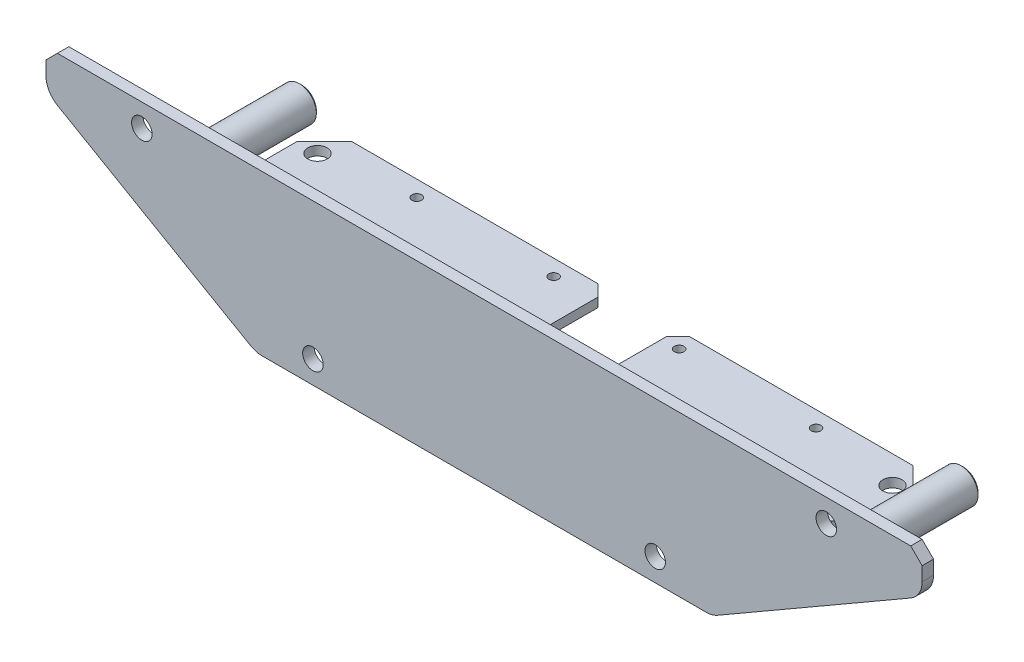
SolidWorks part; units mm, degrees
ref_plane "Face" through (0, 0, 0) normal (0, 0, 1) x (1, 0, 0)
ref_plane "Dessus" through (0, 0, 0) normal (0, 1, 0) x (1, 0, 0)
ref_plane "Droite" through (0, 0, 0) normal (1, 0, 0) x (0, 0, -1)
sketch "Esquisse1" plane through (0, 0, 0) normal (0, 0, 1) x (1, 0, 0)
  line L5 (135, 36) -> (-135, 36)
  line L8 (135, 32) -> (-135, 32)
  line L9 (-135, 32) -> (-135, 36)
  line L11 (135, 32) -> (135, 36)
  dimension "D2" = 32
  dimension "D9" = 4
  dimension "D10" = 270
  dimension "D11" = 135
extrude "Extrusion1" add sketch "Esquisse1" against normal blind 60
sketch "Esquisse2" plane through (0, 0, 0) normal (0, 0, 1) x (1, 0, 0)
  line L0 (100, 0) -> (192, 53.1162)
  line L1 (192, 53.1162) -> (192, 70)
  line L2 (-192, 70) -> (192, 70)
  line L3 (-192, 70) -> (-192, 53.1162)
  line L4 (-192, 53.1162) -> (-100, 0)
  line L6 (-100, 0) -> (100, 0)
  dimension "D1" = 192
  dimension "D2" = 384
  dimension "D3" = 30
  dimension "D4" = 30
  dimension "D5" = 70
  dimension "D6" = 100
extrude "Extrusion2" add sketch "Esquisse2" along normal blind 5 separate body
sketch "Esquisse4" plane through (0, 0, 0) normal (0, 0, -1) x (-1, 0, 0)
  line L0 (-192, 70) -> (192, 70) construction
  circle A0 centre (-150, 60) radius 4.5
  circle A1 centre (-75, 10) radius 4.5
  circle A2 centre (150, 60) radius 4.5
  circle A3 centre (75, 10) radius 4.5
  dimension "D1" = 9
  dimension "D2" = 150
  dimension "D3" = 150
  dimension "D4" = 50
  dimension "D5" = 10
  dimension "D6" = 75
  dimension "D7" = 75
extrude "Enlèv. mat.-Extru.3" cut sketch "Esquisse4" against normal blind 5
sketch "Esquisse6" plane through (0, 0, 0) normal (0, 0, -1) x (-1, 0, 0)
  circle A0 centre (-145, 40) radius 7.5
  circle A1 centre (145, 40) radius 7.5
  dimension "D1" = 15
  dimension "D2" = 15
  dimension "D3" = 40
  dimension "D4" = 145
  dimension "D5" = 145
extrude "Extrusion3" add sketch "Esquisse6" along normal blind 60 separate body
hole_wizard "Trou taraudé M81" positions "Esquisse8" profile "Esquisse7" tap size "M8" standard "ISO"
sketch "Esquisse8" plane through (0, 0, -60) normal (0, 0, -1) x (-1, 0, 0)
  point P0 (-145, 40)
  point P1 (145, 40)
sketch "Esquisse7" plane through (145, 40, -60) normal (1, 0, 0) x (0, 1, 0)
  line L0 (0, 0) -> (0, 21.963)
  line L1 (0, 21.963) -> (3.4, 20)
  line L2 (3.4, 20) -> (3.4, 0)
  line L5 (3.4, 0) -> (0, 0)
  line L10 (0, 21.963) -> (-3.4, 20) construction
  line L11 (0, -6.35) -> (0, 107.95) construction
  dimension "Diamètre du trou pour taraudage" = 6.8
  dimension "Profondeur du trou pour taraudage" = 20
  dimension "Angle de pointe" = 120
chamfer "Chanfrein2" distance 1 angle 45 1 edges at (137.5, 40, -60)
chamfer "Chanfrein3" distance 1 angle 45 1 edges at (-152.5, 40, -60)
sketch "Esquisse9" plane through (0, 36, 0) normal (0, 1, 0) x (-1, 0, 0)
  circle A0 centre (126, -48) radius 4.25
  circle A1 centre (-126, -48) radius 4.25
  dimension "D1" = 8.5
  dimension "D2" = 8.5
  dimension "D3" = 126
  dimension "D4" = 126
  dimension "D5" = 48
extrude "Enlèv. mat.-Extru.5" cut sketch "Esquisse9" against normal blind 5
sketch "Esquisse10" plane through (0, 0, 0) normal (0, 0, -1) x (-1, 0, 0)
  line L0 (135, 32) -> (-135, 32) construction
  line L1 (-42, 32) -> (-32, 32)
  line L2 (-42, 32) -> (-42, 2)
  line L3 (-42, 2) -> (-32, 2)
  line L4 (-32, 32) -> (-32, 2)
  line L6 (13, 32) -> (23, 32)
  line L7 (13, 32) -> (13, 2)
  line L8 (13, 2) -> (23, 2)
  line L9 (23, 32) -> (23, 2)
  dimension "D1" = 30
  dimension "D2" = 10
  dimension "D3" = 32
  dimension "D4" = 10
  dimension "D5" = 65
extrude "Extrusion4" add sketch "Esquisse10" along normal blind 32 separate body
hole_wizard "Trou taraudé M41" positions "Esquisse13" profile "Esquisse12" tap size "M4" standard "ISO"
sketch "Esquisse13" plane through (0, 0, -32) normal (0, 0, -1) x (-1, 0, 0)
  line L0 (-42, 2) -> (-32, 2) construction
  line L1 (-32, 2) -> (-32, 32) construction
  line L2 (13, 32) -> (13, 2) construction
  point P0 (-37, 27)
  point P1 (-37, 7)
  point P9 (18, 27)
  point P11 (18, 7)
  dimension "D1" = 20
  dimension "D2" = 5
  dimension "D3" = 5
  dimension "D4" = 5
sketch "Esquisse12" plane through (37, 27, -32) normal (1, 0, 0) x (0, 1, 0)
  line L0 (0, 0) -> (0, 11.0526)
  line L1 (0, 11.0526) -> (1.65, 10.1)
  line L2 (1.65, 10.1) -> (1.65, 0)
  line L5 (1.65, 0) -> (0, 0)
  line L10 (0, 11.0526) -> (-1.65, 10.1) construction
  line L11 (0, -6.35) -> (0, 107.95) construction
  dimension "Diamètre du trou pour taraudage" = 3.3
  dimension "Profondeur du trou pour taraudage" = 10.1
  dimension "Angle de pointe" = 120
hole_wizard "Trou taraudé M51" positions "Esquisse15" profile "Esquisse14" tap size "M5" standard "ISO"
sketch "Esquisse15" plane through (0, 36, 0) normal (0, 1, 0) x (-1, 0, 0)
  line L0 (-135, 0) -> (135, 0) construction
  line L1 (-27.5, -23) -> (27.5, -23) construction
  line L2 (0, -23) -> (0, 0) construction
  point P0 (-27.5, -53)
  point P1 (-27.5, -23)
  point P2 (-87.5, -23)
  point P4 (27.5, -23)
  point P5 (27.5, -53)
  point P6 (87.5, -23)
  point P17 (-87.5, -53)
  point P19 (87.5, -53)
  dimension "D1" = 60
  dimension "D2" = 23
  dimension "D3" = 60
  dimension "D4" = 30
  dimension "D5" = 55
  dimension "D6" = 30
sketch "Esquisse14" plane through (27.5, 36, -53) normal (1, 0, 0) x (0, 0, 1)
  line L0 (0, 0) -> (0, 36)
  line L1 (0, 36) -> (2.1, 36)
  line L2 (2.1, 36) -> (2.1, 0)
  line L5 (2.1, 0) -> (0, 0)
  line L11 (0, -6.35) -> (0, 107.95) construction
  dimension "Diamètre du trou pour taraudage jusqu'au prochain" = 4.2
  dimension "Profondeur du trou pour taraudage jusqu'au prochain" = 36
chamfer "Chanfrein4" distance 12 angle 45 2 edges at (-135, 34, -60) (135, 34, -60)
chamfer "Chanfrein5" distance 5 angle 45 2 edges at (192, 70, 2.5) (-192, 70, 2.5)
fillet "Congé1" radius 10 4 edges at (-192, 53.1162, 2.5) (-100, 0, 2.5) (100, 0, 2.5) (192, 53.1162, 2.5)
sketch "Esquisse16" plane through (0, 36, 0) normal (0, 1, 0) x (-1, 0, 0)
  line L0 (-135, -30) -> (-105, 0)
  line L1 (-135, -48) -> (-135, 0) construction
  line L2 (-187, 0) -> (187, 0) construction
  dimension "D1" = 30
  dimension "D2" = 30
extrude "Enlèv. mat.-Extru.6" cut sketch "Esquisse16" against normal through all and the other way through all
mirror "Symétrie1" about plane through (0, 0, 0) normal (1, 0, 0) of "Enlèv. mat.-Extru.6"
chamfer "Chanfrein6" distance 2 angle 45 1 edges at (141.6, 40, -60)
chamfer "Chanfrein7" distance 2 angle 45 1 edges at (-148.4, 40, -60)
sketch "Esquisse17" plane through (0, 36, 0) normal (0, 1, 0) x (-1, 0, 0)
  line L0 (-20, -60) -> (-20, -25)
  line L1 (-123, -60) -> (123, -60) construction
  line L2 (-20, -60) -> (10, -60)
  line L3 (10, -60) -> (10, -25)
  arc A0 (-20, -25) -> (10, -25) centre (-5, -25) cw
  dimension "D1" = 30
  dimension "D2" = 20
  dimension "D3" = 35
extrude "Enlèv. mat.-Extru.7" cut sketch "Esquisse17" against normal blind 10
chamfer "Chanfrein8" distance 5 angle 45 2 edges at (-10, 34, -60) (20, 34, -60)
